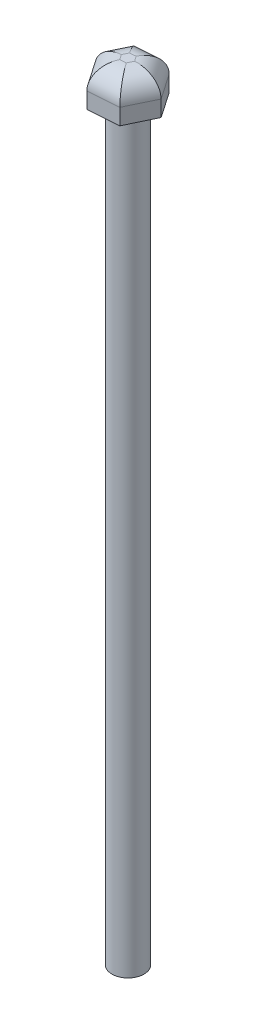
SolidWorks part; units mm, degrees
ref_plane "Front Plane" through (0, 0, 0) normal (0, 0, 1) x (1, 0, 0)
ref_plane "Top Plane" through (0, 0, 0) normal (0, 1, 0) x (1, 0, 0)
ref_plane "Right Plane" through (0, 0, 0) normal (1, 0, 0) x (0, 0, -1)
sketch "Sketch1" plane through (0, 0, 0) normal (0, 1, 0) x (1, 0, 0)
  circle A0 centre (0, 0) radius 1.5
  dimension "D1" = 3
extrude "Boss-Extrude1" add sketch "Sketch1" along normal blind 70
sketch "Sketch2" plane through (0, 70, 0) normal (0, 1, 0) x (1, 0, 0)
  line L1 (-2.8788, -0.2147) -> (-1.2534, -2.6004)
  line L2 (-1.2534, -2.6004) -> (1.6253, -2.3857)
  line L3 (1.6253, -2.3857) -> (2.8788, 0.2147)
  line L4 (2.8788, 0.2147) -> (1.2534, 2.6004)
  line L5 (1.2534, 2.6004) -> (-1.6253, 2.3857)
  line L6 (-1.6253, 2.3857) -> (-2.8788, -0.2147)
  circle A0 centre (0, 0) radius 2.5 construction
  dimension "D1" = 5
extrude "Boss-Extrude2" add sketch "Sketch2" along normal blind 3.5
fillet "Fillet2" radius 2 6 edges at (-0.1859, 73.5, -2.4931) (2.0661, 73.5, -1.4076) (2.252, 73.5, 1.0855) (0.1859, 73.5, 2.4931) (-2.0661, 73.5, 1.4076) (-2.252, 73.5, -1.0855)
